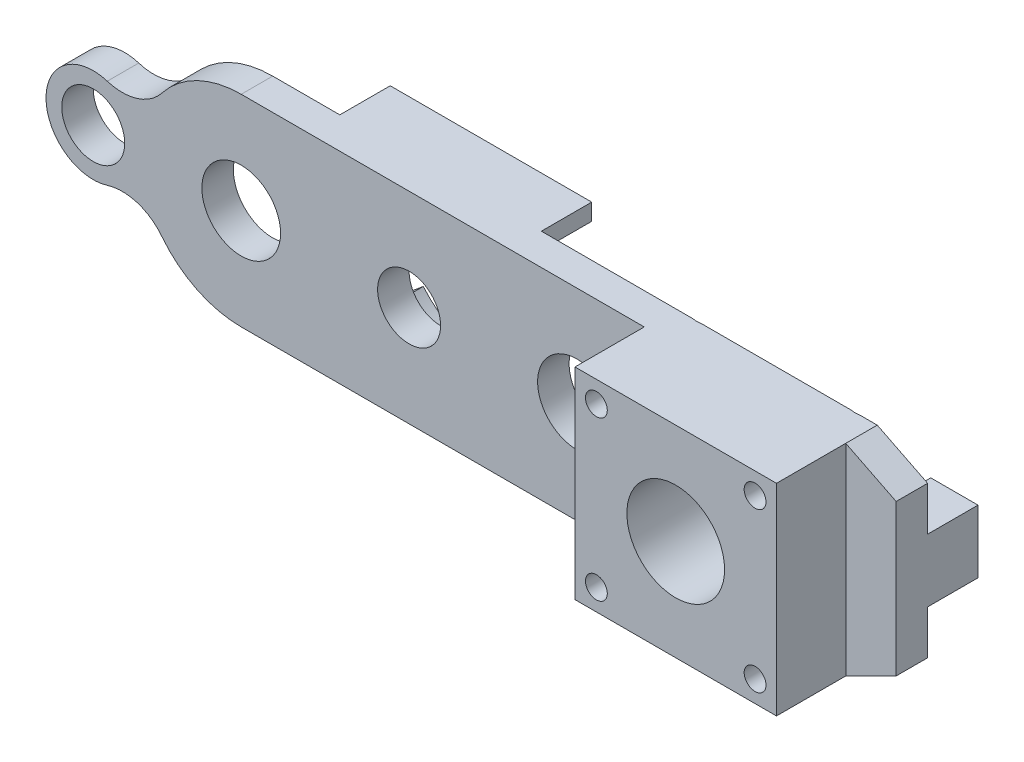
SolidWorks part; units mm, degrees
ref_plane "Front Plane" through (0, 0, 0) normal (0, 0, 1) x (1, 0, 0)
ref_plane "Top Plane" through (0, 0, 0) normal (0, 1, 0) x (1, 0, 0)
ref_plane "Right Plane" through (0, 0, 0) normal (1, 0, 0) x (0, 0, -1)
sketch "Sketch1" plane through (0, 0, 0) normal (0, 0, 1) x (1, 0, 0)
  line L0 (-5.08, 20.32) -> (-5.08, 0) construction
  line L1 (-66.04, 0) -> (-5.08, 0)
  line L2 (-80.9625, 10.16) -> (-72.39, 10.16) construction
  line L3 (-66.04, 20.32) -> (-5.08, 20.32)
  line L4 (0, 2.54) -> (0, 17.78)
  line L5 (-80.9625, 10.16) -> (-80.9625, 0) construction
  line L6 (-5.08, 0) -> (0, 2.54)
  line L7 (-80.9625, 10.16) -> (-47.3235, 10.16) construction
  line L8 (-47.3235, 10.16) -> (-47.3235, 21.59) construction
  line L9 (-72.39, 20.32) -> (-72.39, 0) construction
  line L10 (-80.9625, 0) -> (-72.39, 0) construction
  line L11 (-25.4, 20.32) -> (-25.4, 0) construction
  line L12 (-5.08, 0) -> (0, 0) construction
  line L13 (-5.08, 20.32) -> (0, 17.78)
  line L14 (-80.9625, 15.24) -> (-80.9625, 36.7949) construction
  line L15 (-47.3235, 21.59) -> (-80.9625, 21.59) construction
  line L16 (-47.3235, 15.875) -> (-80.9625, 15.875) construction
  line L17 (-80.9625, 10.16) -> (-80.9625, 113.8471) construction
  line L18 (-80.9625, 113.8471) -> (0, 0) construction
  line L19 (0, 10.16) -> (27.486, 10.16) construction
  line L20 (0, 10.16) -> (-15.24, 10.16) construction
  line L21 (0, 2.54) -> (0, 0) construction
  line L23 (-32.1818, 10.16) -> (-66.04, 10.16) construction
  line L24 (-72.39, 10.16) -> (-66.04, 10.16) construction
  circle A0 centre (-66.04, 10.16) radius 3.9687
  arc A1 (-74.0383, 3.8948) -> (-66.04, 0) centre (-66.04, 10.16) ccw
  arc A2 (-79.5472, 14.7073) -> (-79.5472, 5.6127) centre (-80.9625, 10.16) ccw
  circle A3 centre (-80.9625, 10.16) radius 3.175
  arc A4 (-79.5472, 14.7073) -> (-74.0383, 16.4252) centre (-78.0374, 19.5578) ccw
  circle A5 centre (-80.9625, 113.8471) radius 139.7 construction
  circle A6 centre (-15.24, 10.16) radius 4.9259
  circle A7 centre (-32.1818, 10.16) radius 3.9688
  circle A8 centre (-49.1109, 10.16) radius 3.175
  circle A9 centre (-32.1818, 10.16) radius 8.4645 construction
  circle A10 centre (-49.1109, 10.16) radius 8.4645 construction
  circle A11 centre (-66.04, 10.16) radius 8.4645 construction
  arc A12 (-66.04, 20.32) -> (-74.0383, 16.4252) centre (-66.04, 10.16) ccw
  arc A13 (-79.5472, 5.6127) -> (-74.0383, 3.8948) centre (-78.0374, 0.7622) cw
  point P41 (-76.2, 10.16)
  dimension "D4" = 6.35
  dimension "D5" = 10.16
  dimension "D6" = 7.9375
  dimension "D8" = 11.43
  dimension "D2" = 5.08
  dimension "D9" = 139.7
  dimension "D13" = 33.8582
  dimension "D14" = 4.7625
  dimension "D15" = 15.24
  dimension "D11" = 16.9418
  dimension "D17" = 10.16
  dimension "D18" = 10.16
  dimension "D3" = 20.32
  dimension "D7" = 6.35
  dimension "D10" = 25.4
  dimension "D16" = 14.9225
extrude "Boss-Extrude1" add sketch "Sketch1" along normal blind 3.175
sketch "Sketch2" plane through (0, 0, 3.175) normal (0, 0, -1) x (-1, 0, 0)
  line L0 (66.04, 0) -> (5.08, 0) construction
  line L1 (60.452, 0) -> (38.5318, 0)
  line L2 (60.452, 0) -> (60.452, 4.7625)
  line L3 (60.452, 4.7625) -> (38.5318, 4.7625)
  line L4 (38.5318, 0) -> (38.5318, 4.7625)
  line L5 (49.1109, 4.7625) -> (49.1109, 10.16) construction
  circle A0 centre (66.04, 10.16) radius 3.9688 construction
  circle A1 centre (32.1818, 10.16) radius 3.9688 construction
  dimension "D1" = 4.7625
  dimension "D2" = 5.588
  dimension "D3" = 6.35
extrude "Boss-Extrude2" [suppressed] add sketch "Sketch2" against normal blind 76.2
sketch "Sketch3" [suppressed] plane through (0, 0, 80.9625) normal (0, 0, 1) x (1, 0, 0)
  line L0 (-71.12, 1.3612) -> (-71.12, 15.24)
  line L1 (-71.12, 15.24) -> (-57.4294, 15.24)
  line L2 (-27.1018, 15.24) -> (-27.1018, 0)
  line L3 (-27.1018, 0) -> (-66.04, 0)
  line L4 (-49.4919, 4.7625) -> (-49.4919, 15.24) construction
  line L5 (-60.452, 4.7625) -> (-38.5318, 4.7625) construction
  line L6 (-38.5318, 0) -> (-60.452, 0) construction
  line L7 (-57.4294, 4.7625) -> (-57.4294, 15.24)
  line L8 (-41.5544, 4.7625) -> (-41.5544, 15.24)
  line L9 (-41.5544, 15.24) -> (-27.1018, 15.24)
  line L10 (-41.5544, 15.24) -> (-57.4294, 15.24) construction
  line L11 (-57.4294, 4.7625) -> (-41.5544, 4.7625)
  circle A0 centre (-66.04, 10.16) radius 3.175
  circle A1 centre (-32.1818, 10.16) radius 3.175
  circle A2 centre (-66.04, 10.16) radius 3.175 construction
  circle A3 centre (-32.1818, 10.16) radius 3.175 construction
  arc A4 (-71.12, 1.3612) -> (-66.04, 0) centre (-66.04, 10.16) ccw
  dimension "D2" = 5.08
  dimension "D3" = 6.35
  dimension "D5" = 5.08
  dimension "D1" = 5.08
  dimension "D4" = 15.875
extrude "Boss-Extrude3" [suppressed] add sketch "Sketch3" along normal blind 4.7625
sketch "Sketch8" [suppressed] plane through (0, 4.7625, 0) normal (0, 1, 0) x (1, 0, 0)
  line L0 (-60.452, -4.7625) -> (-38.5318, -4.7625) construction
  line L1 (-44.7294, -4.7625) -> (-54.2544, -4.7625)
  line L2 (-41.5544, -7.9375) -> (-41.5544, -85.725)
  line L3 (-41.5544, -85.725) -> (-57.4294, -85.725)
  line L4 (-57.4294, -7.9375) -> (-57.4294, -85.725)
  line L5 (-41.5544, -85.725) -> (-57.4294, -85.725) construction
  line L6 (-49.4919, -85.725) -> (-49.4919, -4.7625) construction
  line L7 (-41.5544, -85.725) -> (-41.5544, -80.9625) construction
  arc A0 (-54.2544, -4.7625) -> (-57.4294, -7.9375) centre (-54.2544, -7.9375) ccw
  arc A1 (-44.7294, -4.7625) -> (-41.5544, -7.9375) centre (-44.7294, -7.9375) cw
  point P14 (-41.5544, -4.7625)
  dimension "D2" = 3.175
extrude "Cut-Extrude2" [suppressed] cut sketch "Sketch8" against normal blind 1.5875
sketch "Sketch13" plane through (0, 0, 3.175) normal (0, 0, 1) x (1, 0, 0)
  line L0 (-66.04, 0) -> (-5.08, 0) construction
  line L1 (-5.08, 20.32) -> (-25.4, 20.32)
  line L2 (-5.08, 20.32) -> (-5.08, 0)
  line L3 (-5.08, 0) -> (-25.4, 0)
  line L4 (-25.4, 20.32) -> (-25.4, 0)
  circle A0 centre (-15.24, 10.16) radius 4.9259
extrude "Boss-Extrude5" add sketch "Sketch13" along normal offset from surface (6.985 mm away) 10.16
hole_wizard "CSK for M2 Flat Head Machine Screw1" positions "Sketch5" profile "Sketch4" countersink size "M2" standard "ANSI Metric"
sketch "Sketch5" plane through (0, 0, 0) normal (0, 0, -1) x (-1, 0, 0)
  line L0 (7.239, 18.161) -> (23.241, 18.161) construction
  line L1 (23.241, 18.161) -> (23.241, 2.159) construction
  line L2 (23.241, 2.159) -> (7.239, 2.159) construction
  line L3 (7.239, 2.159) -> (7.239, 18.161) construction
  line L5 (7.239, 10.16) -> (15.24, 10.16) construction
  line L7 (15.24, 18.161) -> (15.24, 10.16) construction
  point P0 (7.239, 18.161)
  point P2 (23.241, 18.161)
  point P4 (23.241, 2.159)
  point P6 (7.239, 2.159)
  dimension "D1" = 16.002
sketch "Sketch4" plane through (-7.239, 18.161, 0) normal (1, 0, 0) x (0, 1, 0)
  line L0 (0, 0) -> (0, 10.16)
  line L1 (0, 10.16) -> (1.1, 10.16)
  line L2 (1.1, 10.16) -> (1.1, 1.1)
  line L3 (1.1, 1.1) -> (2.2, 0)
  line L5 (2.2, 0) -> (0, 0)
  line L6 (-1.1, 1.1) -> (-2.2, 0) construction
  line L11 (0, -6.35) -> (0, 107.95) construction
  dimension "Thru Hole Dia." = 2.2
  dimension "Thru Hole Depth" = 10.16
  dimension "Near C'Sink Dia." = 4.4
  dimension "Near C'Sink Angle" = 90
fillet "Fillet1" [suppressed] radius 3.175
sketch "Sketch6" [suppressed] plane through (0, 4.7625, 0) normal (0, 1, 0) x (1, 0, 0)
  line L0 (-63.627, -4.7625) -> (-35.3568, -4.7625) construction
  line L1 (-50.2838, -4.7625) -> (-56.2452, -4.7625)
  line L2 (-50.2838, -4.7625) -> (-50.2838, -18.7738)
  line L3 (-50.2838, -18.7738) -> (-56.2452, -18.7738)
  line L4 (-56.2452, -4.7625) -> (-56.2452, -18.7738)
extrude "Cut-Extrude1" [suppressed] cut sketch "Sketch6" against normal through all
fillet "Fillet2" [suppressed] radius 1.5875
sketch "Sketch11" plane through (0, 0, 0) normal (0, 0, -1) x (-1, 0, 0)
  line L0 (49.1109, 10.16) -> (49.1109, 20.32) construction
  line L1 (23.6638, 20.32) -> (66.04, 20.32) construction
  line L2 (59.2709, 20.32) -> (38.9509, 20.32)
  line L3 (38.9509, 20.32) -> (38.9509, 18.6412)
  line L4 (38.9509, 18.6412) -> (42.2862, 15.857)
  line L5 (59.2709, 18.6412) -> (55.9356, 15.857)
  line L6 (59.2709, 20.32) -> (59.2709, 18.6412)
  line L7 (49.1109, 10.16) -> (66.04, 10.16) construction
  line L10 (59.2709, 0) -> (59.2709, 1.6788)
  line L11 (59.2709, 1.6788) -> (55.9356, 4.463)
  line L12 (59.2709, 0) -> (38.9509, 0)
  line L13 (38.9509, 1.6788) -> (42.2862, 4.463)
  line L14 (38.9509, 0) -> (38.9509, 1.6788)
  line L15 (0, 13.335) -> (4.7625, 13.335)
  line L16 (0, 2.54) -> (0, 17.78) construction
  line L17 (4.7625, 13.335) -> (4.7625, 6.985)
  line L18 (4.7625, 6.985) -> (0, 6.985)
  line L19 (0, 6.985) -> (0, 13.335)
  line L20 (4.7625, 10.16) -> (15.24, 10.16) construction
  arc A0 (55.9356, 15.857) -> (42.2862, 15.857) centre (49.1109, 10.16) ccw
  circle A1 centre (32.1818, 10.16) radius 10.16 construction
  arc A2 (55.9356, 4.463) -> (42.2862, 4.463) centre (49.1109, 10.16) cw
  dimension "D1" = 8.89
  dimension "D2" = 20.32
  dimension "D3" = 6.35
  dimension "D4" = 4.7625
extrude "Boss-Extrude4" add sketch "Sketch11" along normal blind 5.08
sketch "Sketch14" plane through (0, 0, 0) normal (0, 0, -1) x (-1, 0, 0)
  circle A0 centre (32.1818, 10.16) radius 3.9687
  circle A1 centre (66.04, 10.16) radius 3.9687
  dimension "D1" = 7.9375
extrude "Cut-Extrude3" [suppressed] cut sketch "Sketch14" against normal blind 3.5
